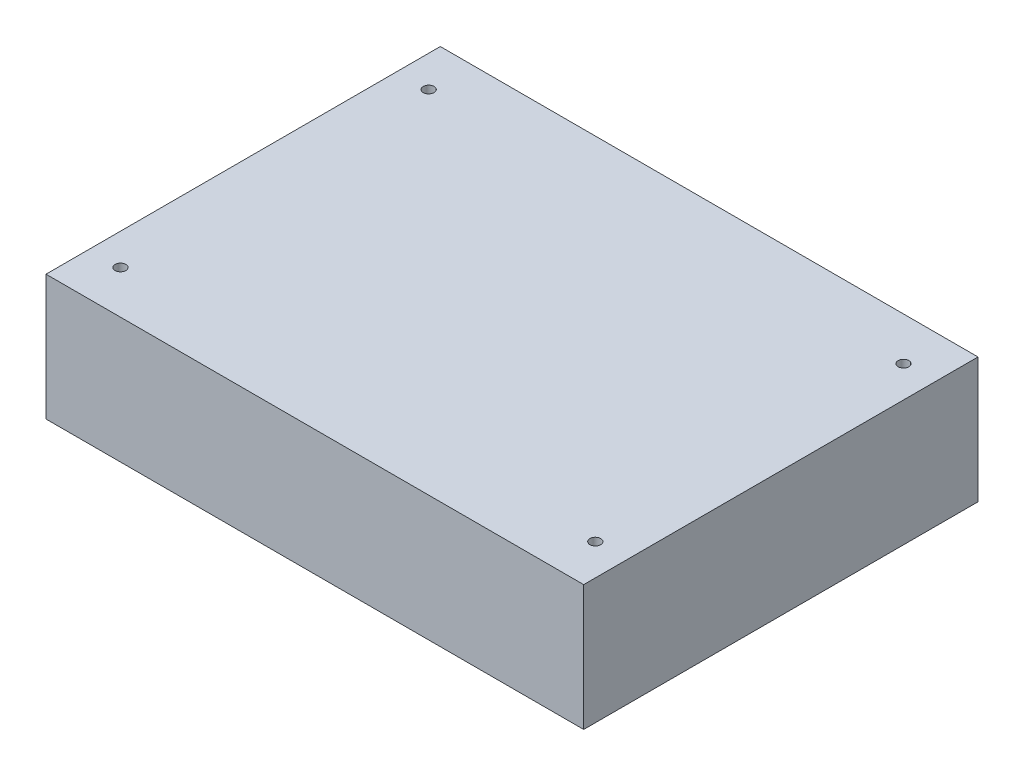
SolidWorks part; units mm, degrees
ref_plane "前视基准面" through (0, 0, 0) normal (0, 0, 1) x (1, 0, 0)
ref_plane "上视基准面" through (0, 0, 0) normal (0, 1, 0) x (1, 0, 0)
ref_plane "右视基准面" through (0, 0, 0) normal (1, 0, 0) x (0, 0, -1)
other "Configuration Table"
sketch "草图1" plane through (0, 0, 0) normal (0, 1, 0) x (1, 0, 0)
  line L1 (-75, -55) -> (75, -55)
  line L2 (-75, -55) -> (-75, 55)
  line L3 (-75, 55) -> (75, 55)
  line L4 (75, -55) -> (75, 55)
  line L5 (-75, -55) -> (75, 55) construction
  line L6 (-75, 55) -> (75, -55) construction
  point P0 (0, 0)
  dimension "D1" = 150
  dimension "D2" = 110
extrude "凸台-拉伸1" add sketch "草图1" along normal blind 35
sketch "草图2" plane through (0, 35, 0) normal (0, 1, 0) x (1, 0, 0)
  line L1 (-66.2305, -42.9895) -> (66.2305, -42.9895) construction
  line L2 (-66.2305, -42.9895) -> (-66.2305, 42.9895) construction
  line L3 (-66.2305, 42.9895) -> (66.2305, 42.9895) construction
  line L4 (66.2305, -42.9895) -> (66.2305, 42.9895) construction
  line L5 (-66.2305, -42.9895) -> (66.2305, 42.9895) construction
  line L6 (-66.2305, 42.9895) -> (66.2305, -42.9895) construction
  circle A0 centre (-66.2305, 42.9895) radius 1.5
  circle A1 centre (-66.2305, -42.9895) radius 1.5
  circle A2 centre (66.2305, -42.9895) radius 1.5
  circle A3 centre (66.2305, 42.9895) radius 1.5
  point P0 (0, 0)
  dimension "D3" = 3
  dimension "D1" = 132.461
  dimension "D2" = 85.979
extrude "切除-拉伸1" cut sketch "草图2" against normal through all
